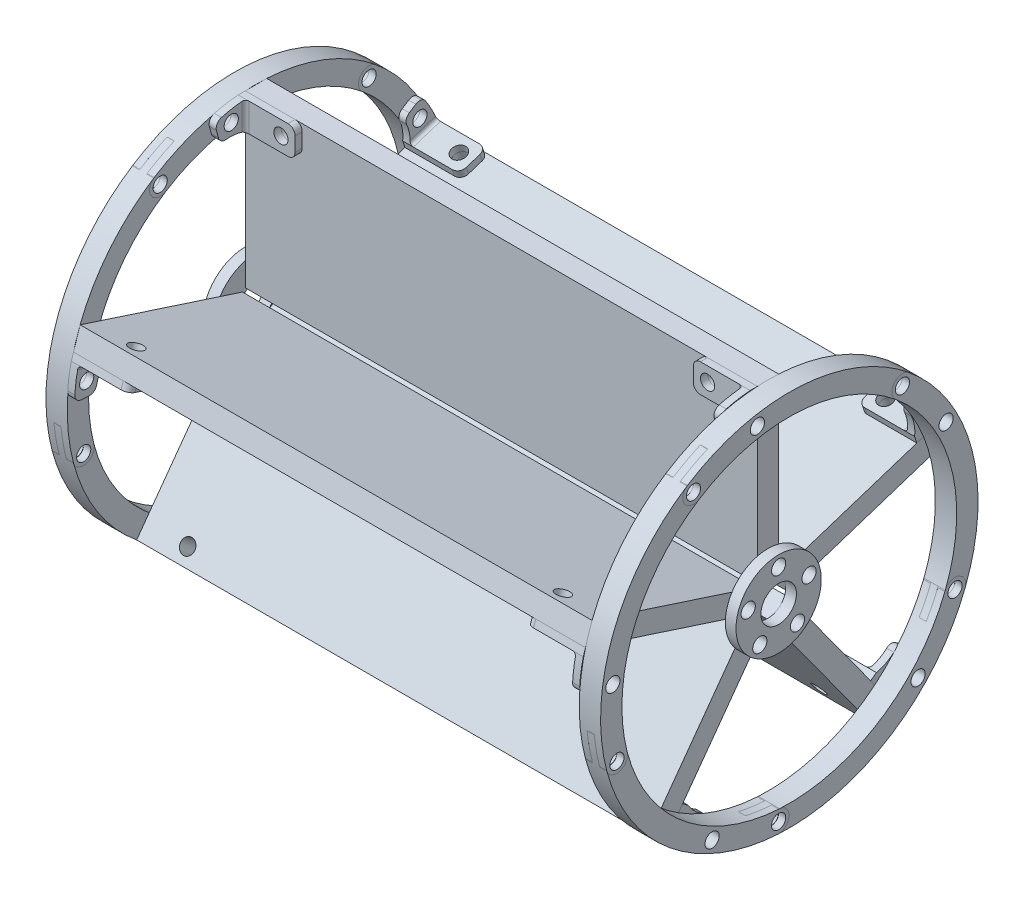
SolidWorks part; units mm, degrees
other "Camera1"
ref_plane "Front Plane" through (0, 0, 0) normal (0, 0, 1) x (1, 0, 0)
ref_plane "Top Plane" through (0, 0, 0) normal (0, 1, 0) x (1, 0, 0)
ref_plane "Right Plane" through (0, 0, 0) normal (1, 0, 0) x (0, 0, -1)
sketch "Sketch1" plane through (0, 0, 0) normal (0, 0, 1) x (1, 0, 0)
  line L0 (228.6, 152.4) -> (228.6, 36.5658) construction
  line L1 (0, 0) -> (457.2, 0)
  line L2 (0, 0) -> (0, 152.4)
  line L3 (0, 152.4) -> (457.2, 152.4)
  line L4 (457.2, 0) -> (457.2, 152.4)
  line L5 (38.1, 139.7) -> (38.1, 152.4) construction
  line L6 (38.1, 139.7) -> (0, 139.7) construction
  circle A0 centre (38.1, 139.7) radius 6.35
  circle A1 centre (419.1, 139.7) radius 6.35
  dimension "D3" = 12.7
  dimension "D1" = 152.4
  dimension "D2" = 457.2
  dimension "D4" = 38.1
  dimension "D5" = 12.7
extrude "Boss-Extrude1" add sketch "Sketch1" along normal blind 19.05
sketch3d "3DSketch1"
  line L0 (457.2, 0, 9.525) -> (457.2, -15.875, 9.525) construction
  line L1 (457.2, 0, 19.05) -> (457.2, 0, 0) construction
  line L2 (457.2, -15.875, 9.525) -> (-113.5205, -15.875, 9.525) construction
  circle A1 centre (457.2, -15.875, 9.525) radius 15.875 construction
  point P7 (473.075, -15.875, 9.525)
  dimension "D1" = 31.75
pattern_circular "CirPattern1" count 5 over 360 about axis through (0, -15.875, 9.525) along (1, 0, 0)
sketch "Sketch5" plane through (457.2, 0, 0) normal (1, 0, 0) x (0, 0, -1)
  line L0 (-19.05, 0) -> (0, 0) construction
  line L1 (-11.1502, -34.3168) -> (-26.562, -23.1195) construction
  circle A0 centre (-9.525, -15.875) radius 15.875
  circle A1 centre (-9.525, -15.875) radius 38.1
  dimension "D1" = 31.75
  dimension "D2" = 22.225
extrude "Boss-Extrude2" add sketch "Sketch5" along normal blind 9.525 separate body
sketch "Sketch6" plane through (0, 0, 0) normal (-1, 0, 0) x (0, 0, 1)
  circle A0 centre (9.525, -15.875) radius 15.875
  circle A1 centre (9.525, -15.875) radius 38.1
  circle A2 centre (9.525, -15.875) radius 15.875 construction
  circle A3 centre (9.525, -15.875) radius 38.1 construction
extrude "Boss-Extrude3" add sketch "Sketch6" along normal blind 9.525 separate body
sketch "Sketch4" plane through (457.2, 0, 0) normal (1, 0, 0) x (0, 0, -1)
  line L0 (-9.525, 0) -> (-9.525, 29.1397) construction
  line L1 (-19.05, 0) -> (0, 0) construction
  line L2 (-18.8561, -28.7181) -> (-24.8093, -36.9121) construction
  line L3 (-11.1502, -34.3168) -> (-26.562, -23.1195) construction
  line L4 (-0.1939, -28.7181) -> (7.0559, -38.6966) construction
  line L5 (7.512, -23.1195) -> (-7.8998, -34.3168) construction
  circle A0 centre (-9.525, 12.7) radius 6.35
  circle A1 centre (-9.525, -15.875) radius 15.875 construction
  circle A2 centre (17.6514, -7.0448) radius 6.35
  circle A3 centre (7.271, -38.9927) radius 6.35
  circle A4 centre (-26.321, -38.9927) radius 6.35
  circle A5 centre (-36.7014, -7.0448) radius 6.35
  point P27 (-9.525, -15.875)
  dimension "D1" = 12.7
  dimension "D2" = 12.7
  dimension "D3" = 5
extrude "Cut-Extrude1" cut sketch "Sketch4" against normal through all and the other way through all
sketch "Sketch8" plane through (457.2, 0, 0) normal (1, 0, 0) x (0, 0, -1)
  line L0 (-166.6206, 45.1836) -> (-19.05, 152.4) construction
  line L1 (0, 152.4) -> (147.5706, 45.1836) construction
  line L2 (-92.8353, 98.7918) -> (-108.5929, 120.4803) construction
  line L3 (78.3456, 105.0685) -> (73.7853, 98.7918) construction
  line L4 (-100.7287, 125.861) -> (-89.5112, 110.4214) construction
  line L5 (-95.1199, 118.1412) -> (-102.8258, 112.5425) construction
  line L6 (-89.5112, 110.4214) -> (-85.1294, 104.3905) construction
  line L7 (91.7133, 106.7529) -> (84.1902, 112.595) construction
  line L8 (86.1039, 99.0323) -> (97.3227, 114.4736) construction
  line L9 (81.7336, 93.0171) -> (86.1039, 99.0323) construction
  line L10 (104.1975, 81.1598) -> (115.6769, 96.9598)
  line L11 (102.0749, 78.2382) -> (104.1975, 81.1598) construction
  line L12 (91.7133, 106.7529) -> (109.9372, 89.0598) construction
  line L13 (90.0349, 120.1214) -> (78.3456, 105.0685) construction
  circle A0 centre (-9.525, -15.875) radius 168.5444 construction
  circle A1 centre (-9.525, -15.875) radius 149.4944 construction
  arc A2 (-100.7287, 125.861) -> (-89.5112, 110.4214) centre (-95.106, 118.1513) ccw
  circle A3 centre (-95.1199, 118.1412) radius 6.35
  arc A5 (-100.7287, 125.861) -> (97.3227, 114.4736) centre (-9.525, -15.875) cw
  arc A6 (-89.5112, 110.4214) -> (86.1039, 99.0323) centre (-9.525, -15.875) cw
  arc A7 (86.1039, 99.0323) -> (104.1975, 81.1598) centre (-9.525, -15.875) cw
  arc A8 (97.3227, 114.4736) -> (115.6769, 96.9598) centre (-9.525, -15.875) cw
  arc A10 (86.1039, 99.0323) -> (97.3227, 114.4736) centre (91.7281, 106.7422) cw
  dimension "D1" = 19.05
  dimension "D3" = 12.7
  dimension "D2" = 9.525
  dimension "D4" = 9.525
  dimension "D5" = 25.4
extrude "Boss-Extrude4" add sketch "Sketch8" along normal blind 19.05 separate body
sketch3d "3DSketch4" plane through (0, 0, 0) normal (0, 0, 1) x (1, 0, 0)
  dimension "D1" = 9.525
sketch "Sketch10" plane through (466.725, 0, 0) normal (1, 0, 0) x (0, 0, -1)
  line L0 (102.8534, 82.7133) -> (117.1738, 95.2763)
  line L1 (-9.525, -15.875) -> (102.8534, 82.7133) construction
  circle A1 centre (-9.525, -15.875) radius 168.5444 construction
  circle A2 centre (-9.525, -15.875) radius 149.4944 construction
  arc A3 (97.3227, 114.4736) -> (-100.7287, 125.861) centre (-9.525, -15.875) ccw construction
  arc A4 (85.2211, 99.7612) -> (-89.5112, 110.4214) centre (-9.525, -15.875) ccw construction
  arc A5 (85.2211, 99.7612) -> (97.3227, 114.4736) centre (91.7281, 106.7422) cw
  arc A6 (97.3227, 114.4736) -> (117.1738, 95.2763) centre (-9.525, -15.875) cw
  arc A7 (85.2211, 99.7612) -> (102.8534, 82.7133) centre (-9.525, -15.875) cw
  arc A8 (97.3227, 114.4736) -> (85.2211, 99.7612) centre (91.7281, 106.7422) ccw construction
  circle A9 centre (91.7281, 106.7422) radius 6.35
  dimension "D2" = 12.7
  dimension "D1" = 25.4
extrude "Boss-Extrude6" add sketch "Sketch10" along normal blind 3.175 and the other way blind 3.175
sketch "Sketch11" plane through (466.725, 0, 0) normal (1, 0, 0) x (0, 0, -1)
  line L0 (-76.3774, 138.844) -> (-68.8213, 121.3566)
  line L1 (-68.8213, 121.3566) -> (-9.525, -15.875) construction
  circle A0 centre (-9.525, -15.875) radius 168.5444 construction
  arc A1 (97.3227, 114.4736) -> (-100.7287, 125.861) centre (-9.525, -15.875) ccw construction
  circle A2 centre (-9.525, -15.875) radius 149.4944 construction
  arc A3 (85.2211, 99.7612) -> (-89.5112, 110.4214) centre (-9.525, -15.875) ccw construction
  arc A4 (-100.7287, 125.861) -> (-90.4474, 109.8236) centre (-95.106, 118.1513) ccw
  arc A5 (-100.7287, 125.861) -> (-89.5112, 110.4214) centre (-95.106, 118.1513) ccw construction
  arc A6 (-100.7287, 125.861) -> (-76.3774, 138.844) centre (-9.525, -15.875) cw
  arc A7 (-90.4474, 109.8236) -> (-68.8213, 121.3566) centre (-9.525, -15.875) cw
  dimension "D1" = 25.4
extrude "Cut-Extrude3" cut sketch "Sketch11" against normal blind 3.175 and the other way blind 3.175
pattern_circular "CirPattern3" count 5 over 360 about axis through (0, -15.875, 9.525) along (1, 0, 0)
sketch3d "3DSketch5" plane through (0, 0, 0) normal (0, 0, 1) x (1, 0, 0)
  dimension "D1" = 228.6
sketch "Sketch12" plane through (228.6, 0, 0) normal (-1, 0, 0) x (0, 0, 1)
  line L1 (0, 152.4) -> (-72.0407, 152.4)
  line L2 (0, 152.4) -> (0, 99.1706)
  line L3 (0, 99.1706) -> (-72.0407, 99.1706)
  line L4 (-72.0407, 152.4) -> (-72.0407, 99.1706)
surface "Surface-Plane1" sketch "Sketch12"
mirror "Mirror2" about plane through (228.6, 0, 0) normal (1, 0, 0)
pattern_circular "CirPattern4" count 5 over 360 about axis through (0, -15.875, 9.525) along (1, 0, 0)
sketch "Sketch14" plane through (0, 0, 19.05) normal (0, 0, 1) x (1, 0, 0)
  line L0 (38.1, 139.7) -> (50.8, 139.7) construction
  line L1 (0, 152.4) -> (44.45, 152.4)
  line L2 (0, 152.4) -> (0, 127)
  line L3 (0, 127) -> (44.45, 127)
  line L4 (50.8, 146.05) -> (50.8, 133.35)
  arc A0 (44.45, 127) -> (50.8, 133.35) centre (44.45, 133.35) ccw
  arc A1 (44.45, 152.4) -> (50.8, 146.05) centre (44.45, 146.05) cw
  circle A2 centre (38.1, 139.7) radius 6.35
  point P9 (50.8, 152.4)
  dimension "D3" = 6.35
  dimension "D4" = 12.7
  dimension "D1" = 25.4
  dimension "D2" = 50.8
  dimension "D5" = 12.7
extrude "Boss-Extrude7" add sketch "Sketch14" along normal blind 6.35 separate body
sketch "Sketch15" plane through (0, 0, 0) normal (1, 0, 0) x (0, 0, -1)
  line L0 (-25.4, 151.9201) -> (-25.4, 132.7741)
  line L1 (-52.8172, 147.0145) -> (-47.924, 128.6036)
  line L2 (-36.2721, 131.2071) -> (-9.525, -15.875) construction
  line L4 (-37.9762, 140.5785) -> (-50.3706, 137.8091) construction
  line L5 (-25.4, 142.3471) -> (-37.9762, 140.5785) construction
  line L6 (-57.1621, 145.7972) -> (-51.7778, 127.524) construction
  line L7 (-51.7778, 127.524) -> (-9.525, -15.875) construction
  line L8 (-36.2721, 131.2071) -> (-39.6804, 149.9498) construction
  line L9 (-25.4, 132.7741) -> (-25.4, 127)
  line L10 (-25.4, 151.9201) -> (-25.4, 152.4)
  arc A0 (-52.8172, 147.0145) -> (-25.4, 152.4) centre (-16.5768, 34.9998) cw
  arc A1 (97.3227, 114.4736) -> (-100.7287, 125.861) centre (-9.525, -15.875) ccw construction
  arc A2 (-25.4, 127) -> (-47.924, 128.6036) centre (-38.8434, 97.1625) ccw
  circle A3 centre (-37.9762, 140.5785) radius 6.35
  arc A4 (85.2211, 99.7612) -> (-89.5112, 110.4214) centre (-9.525, -15.875) ccw construction
  dimension "D2" = 12.7
  dimension "D3" = 12.7
extrude "Boss-Extrude8" add sketch "Sketch15" along normal blind 6.35 contours A2 L0 L1 A3 M10 M12 | A2 L9 M10 | A0 L10 M12
fillet "Fillet1" radius 6.35 2 edges at (3.175, 128.6036, 47.924) (3.175, 147.0145, 52.8172)
fillet "Fillet3" radius 3.175 1 edges at (6.35, 139.7, 25.4)
sketch "Sketch16" plane through (0, 0, 0) normal (1, 0, 0) x (0, 0, -1)
  circle A0 centre (-37.9762, 140.5785) radius 6.35
  circle A1 centre (-37.9762, 140.5785) radius 6.35 construction
extrude "Cut-Extrude5" cut sketch "Sketch16" against normal through all both and the other way through all
pattern_circular "CirPattern6" count 5 over 360 about axis through (0, -15.875, 9.525) along (1, 0, 0) of "Cut-Extrude5"
mirror "Mirror3" about plane through (228.6, 0, 0) normal (1, 0, 0)
pattern_circular "CirPattern7" count 5 over 360 about axis through (0, -15.875, 9.525) along (1, 0, 0)
